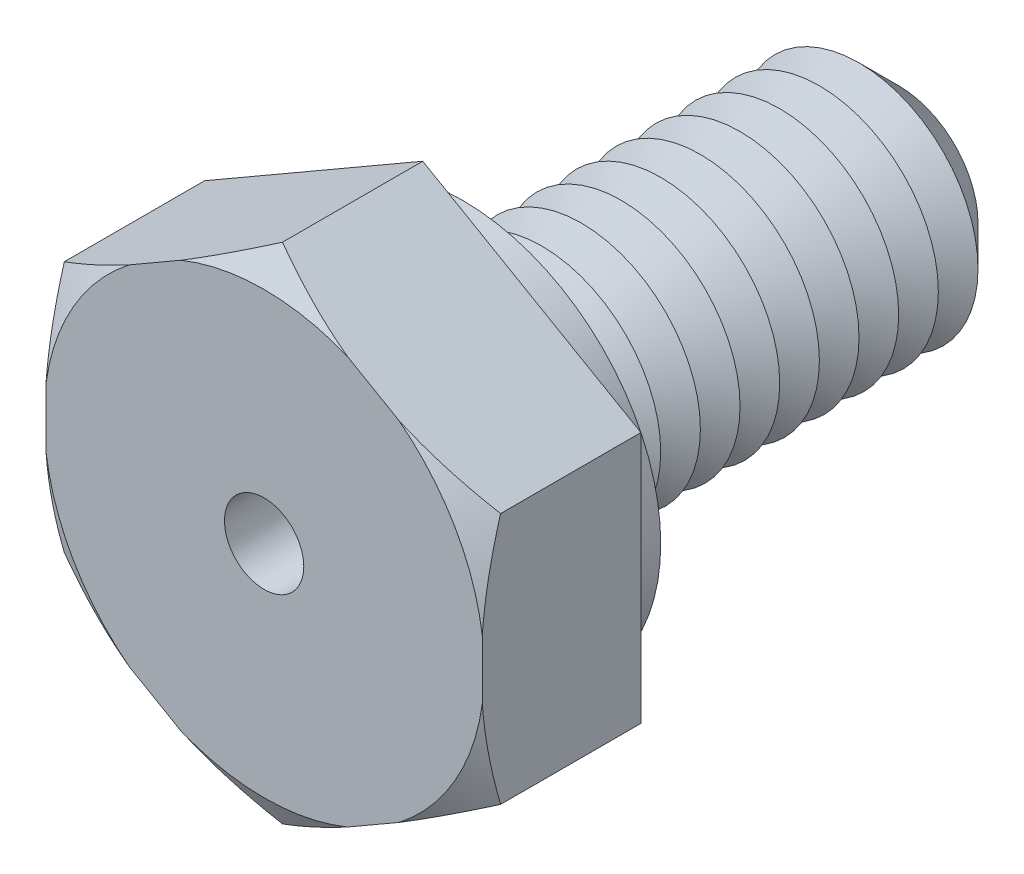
SolidWorks part; units mm, degrees
ref_plane "Front Plane" through (0, 0, 0) normal (0, 0, 1) x (1, 0, 0)
ref_plane "Top Plane" through (0, 0, 0) normal (0, 1, 0) x (1, 0, 0)
ref_plane "Right Plane" through (0, 0, 0) normal (1, 0, 0) x (0, 0, -1)
sketch "Sketch2" plane through (0, 0, 0) normal (0, 0, 1) x (1, 0, 0)
  line L1 (0, 3.1754) -> (-2.75, 1.5877)
  line L2 (-2.75, 1.5877) -> (-2.75, -1.5877)
  line L3 (-2.75, -1.5877) -> (0, -3.1754)
  line L4 (0, -3.1754) -> (2.75, -1.5877)
  line L5 (2.75, -1.5877) -> (2.75, 1.5877)
  line L6 (2.75, 1.5877) -> (0, 3.1754)
  circle A0 centre (0, 0) radius 2.75 construction
  dimension "D1" = 5.5
extrude "Boss-Extrude1" add sketch "Sketch2" along normal blind 2
sketch "Sketch3" plane through (0, 0, 0) normal (0, 0, -1) x (-1, 0, 0)
  circle A0 centre (0, 0) radius 1.5
  dimension "D1" = 3
extrude "Boss-Extrude2" add sketch "Sketch3" along normal blind 6
sketch "Sketch4" plane through (0, 0, 0) normal (0, 0, -1) x (-1, 0, 0)
  circle A0 centre (0, 0) radius 2.5
  dimension "D1" = 5
extrude "Boss-Extrude3" add sketch "Sketch4" along normal blind 0.5
sketch "Sketch5" plane through (0, 0, 0) normal (1, 0, 0) x (0, 0, -1)
  line L0 (-3.2117, 0) -> (6.3192, 0) construction
chamfer "Chamfer1" distance 0.5 angle 45 1 edges at (-1.5, 0, -6)
sketch "Sketch6" plane through (0, 0, 0) normal (1, 0, 0) x (0, 0, -1)
  line L0 (0.5, 1.5) -> (0.75, 1.067)
  line L1 (0.75, 1.067) -> (1, 1.5)
  line L2 (5.5, 1.5) -> (0.5, 1.5) construction
  line L3 (1, 1.5) -> (0.5, 1.5)
  dimension "D1" = 0.5
revolve "Cut-Revolve1" cut sketch "Sketch6" angle 360 about L0
pattern_linear "LPattern1" count 10 spacing 0.5 along (0, 0, -1) of "Cut-Revolve1"
sketch "Sketch7" plane through (0, 0, 0) normal (1, 0, 0) x (0, 0, -1)
  line L0 (-2, 3.1754) -> (-2, 2.7754)
  line L1 (-2, 1.5877) -> (-2, 3.1754) construction
  line L2 (-2, 2.7754) -> (-1.7691, 3.1754)
  line L3 (-2, 3.1754) -> (0, 3.1754) construction
  line L4 (-1.7691, 3.1754) -> (-2, 3.1754)
  dimension "D1" = 0.4
  dimension "D2" = 30
revolve "Cut-Revolve2" cut sketch "Sketch7" angle 360 about L0
sketch "Sketch8" plane through (0, 0, 2) normal (0, 0, 1) x (1, 0, 0)
  circle A0 centre (0, 0) radius 0.5
  dimension "D1" = 1
extrude "Cut-Extrude1" cut sketch "Sketch8" against normal up to surface (8 mm away)
